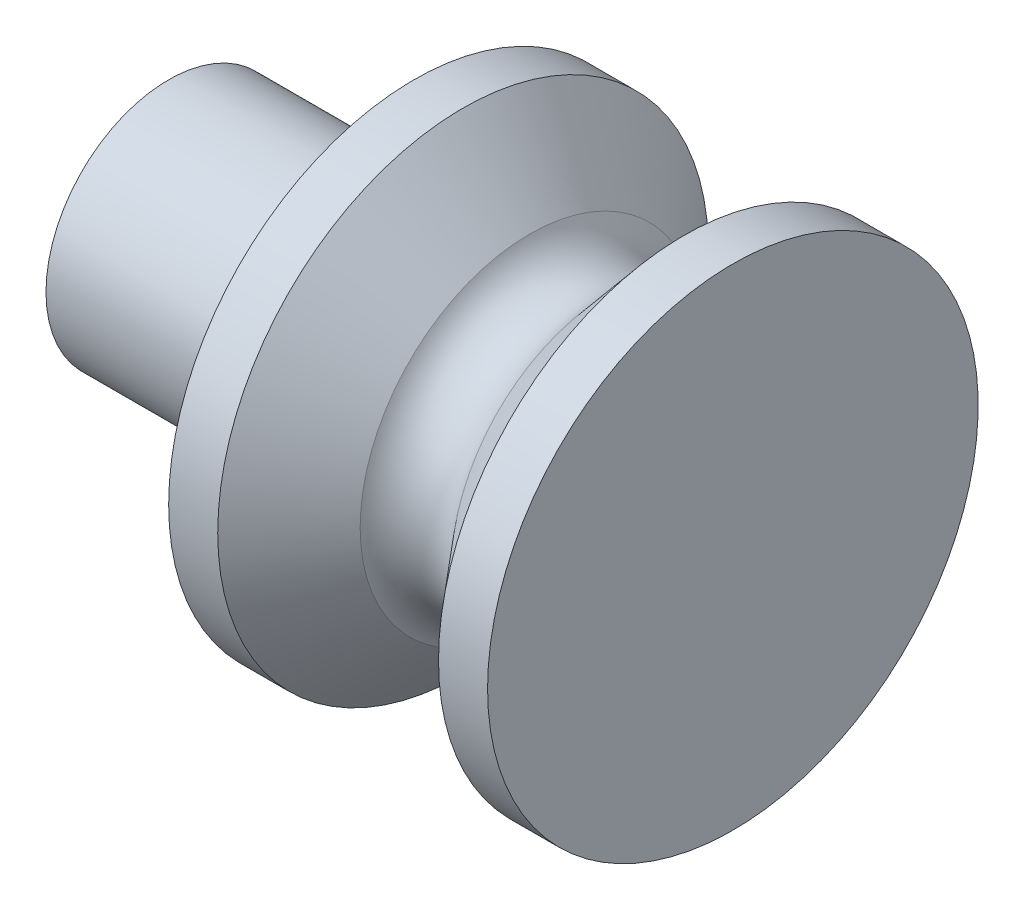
SolidWorks part; units mm, degrees
ref_plane "Front" through (0, 0, 0) normal (0, 0, 1) x (1, 0, 0)
ref_plane "Top" through (0, 0, 0) normal (0, 1, 0) x (1, 0, 0)
ref_plane "Right" through (0, 0, 0) normal (1, 0, 0) x (0, 0, -1)
sketch "Sketch1" plane through (0, 0, 0) normal (0, 0, 1) x (1, 0, 0)
  line L0 (8.1028, 8.5895) -> (14.6028, 8.5895)
  line L1 (14.6028, 8.5895) -> (14.6028, 13.5895)
  line L2 (14.6028, 13.5895) -> (13.6028, 13.5895)
  line L3 (13.6028, 13.5895) -> (12.1142, 11.8412)
  line L4 (3.1028, 9.5895) -> (3.1028, 11.0895)
  line L5 (3.1028, 11.0895) -> (8.1028, 11.0895)
  line L6 (8.1028, 11.0895) -> (8.1028, 13.5895)
  line L7 (8.1028, 13.5895) -> (9.1028, 13.5895)
  line L8 (9.1028, 13.5895) -> (10.4584, 12.0423)
  line L9 (8.1028, 8.5895) -> (8.1028, 9.5895)
  line L10 (8.1028, 9.5895) -> (3.1028, 9.5895)
  arc A0 (12.1142, 11.8412) -> (10.4584, 12.0423) centre (11.3528, 12.4895) cw
  dimension "D6" = 1
  dimension "D1" = 5
  dimension "D2" = 5
  dimension "D3" = 1
  dimension "D4" = 2.5
  dimension "D5" = 6.5
  dimension "D7" = 4.5
  dimension "D8" = 6.5
  dimension "D9" = 3.25
  dimension "D10" = 1.1
  dimension "D11" = 1
  dimension "D12" = 1
revolve "Revolve1" add sketch "Sketch1" angle 360 about L0
sketch "Sketch2" plane through (0, 0, 0) normal (0, 0, 1) x (1, 0, 0)
  circle A0 centre (11.3528, 8.5895) radius 0.001
extrude "Cut-Extrude1" cut sketch "Sketch2" against normal mid plane 70
sketch "Sketch3" plane through (0, 0, 0) normal (0, 0, 1) x (1, 0, 0)
  line L0 (8.1028, 8.5895) -> (14.6028, 8.5895) construction
  point P0 (11.3528, 8.5895)
